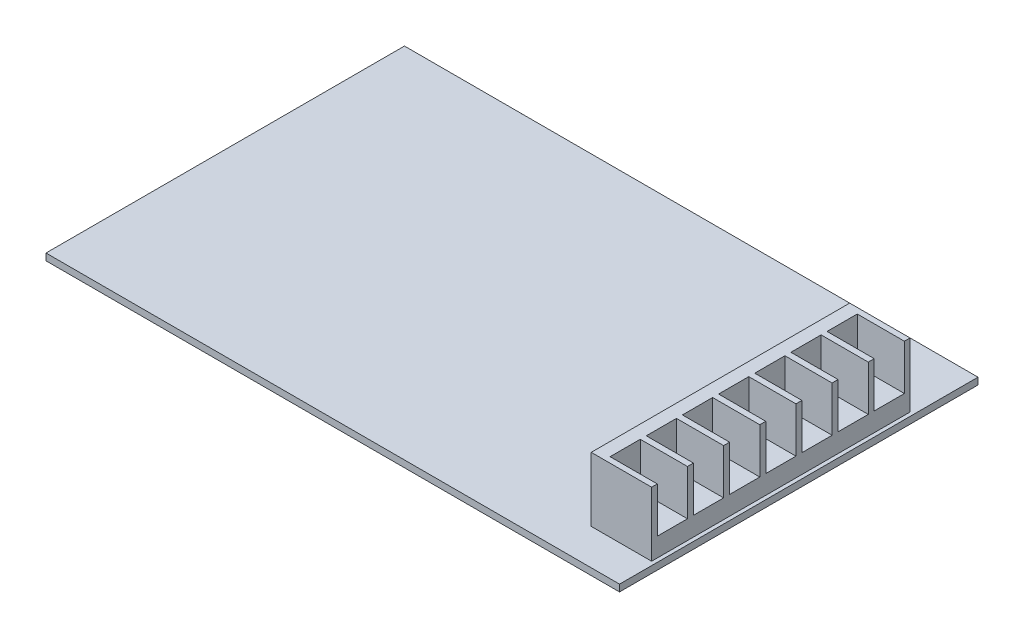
SolidWorks part; units mm, degrees
ref_plane "Спереди" through (0, 0, 0) normal (0, 0, 1) x (1, 0, 0)
ref_plane "Сверху" through (0, 0, 0) normal (0, 1, 0) x (1, 0, 0)
ref_plane "Справа" through (0, 0, 0) normal (1, 0, 0) x (0, 0, -1)
sketch "Эскиз1" plane through (0, 0, 0) normal (0, 1, 0) x (1, 0, 0)
  line L1 (-76, -47.5) -> (76, -47.5)
  line L2 (-76, -47.5) -> (-76, 47.5)
  line L3 (-76, 47.5) -> (76, 47.5)
  line L4 (76, -47.5) -> (76, 47.5)
  line L5 (-76, -47.5) -> (76, 47.5) construction
  line L6 (-76, 47.5) -> (76, -47.5) construction
  point P0 (0, 0)
  dimension "D1" = 152
  dimension "D2" = 95
extrude "Бобышка-Вытянуть1" add sketch "Эскиз1" along normal blind 1.8
sketch "Эскиз2" plane through (0, 1.8, 0) normal (0, 1, 0) x (1, 0, 0)
  line L1 (75, 30.5) -> (59, 30.5)
  line L2 (75, 30.5) -> (75, -38)
  line L3 (75, -38) -> (59, -38)
  line L4 (59, 30.5) -> (59, -38)
  line L5 (-76, -47.5) -> (76, -47.5) construction
  line L6 (76, -47.5) -> (76, 47.5) construction
  dimension "D1" = 9.5
  dimension "D2" = 68.5
  dimension "D3" = 16
  dimension "D4" = 1
extrude "Бобышка-Вытянуть2" add sketch "Эскиз2" along normal blind 17
sketch "Эскиз3" plane through (0, 18.8, 0) normal (0, 1, 0) x (1, 0, 0)
  line L0 (75, -38) -> (75, 30.5) construction
  line L1 (75, -36.5) -> (62.5, -36.5)
  line L2 (75, -36.5) -> (75, -28.5)
  line L3 (75, -28.5) -> (62.5, -28.5)
  line L4 (62.5, -36.5) -> (62.5, -28.5)
  line L5 (59, -38) -> (75, -38) construction
  line L6 (75, -18.9167) -> (62.5, -18.9167)
  line L7 (75, -26.9167) -> (75, -18.9167)
  line L8 (75, -26.9167) -> (62.5, -26.9167)
  line L9 (62.5, -26.9167) -> (62.5, -18.9167)
  line L10 (75, -9.3333) -> (62.5, -9.3333)
  line L11 (75, -17.3333) -> (75, -9.3333)
  line L12 (75, -17.3333) -> (62.5, -17.3333)
  line L13 (62.5, -17.3333) -> (62.5, -9.3333)
  line L14 (75, 0.25) -> (62.5, 0.25)
  line L15 (75, -7.75) -> (75, 0.25)
  line L16 (75, -7.75) -> (62.5, -7.75)
  line L17 (62.5, -7.75) -> (62.5, 0.25)
  line L18 (75, 9.8333) -> (62.5, 9.8333)
  line L19 (75, 1.8333) -> (75, 9.8333)
  line L20 (75, 1.8333) -> (62.5, 1.8333)
  line L21 (62.5, 1.8333) -> (62.5, 9.8333)
  line L22 (75, 19.4167) -> (62.5, 19.4167)
  line L23 (75, 11.4167) -> (75, 19.4167)
  line L24 (75, 11.4167) -> (62.5, 11.4167)
  line L25 (62.5, 11.4167) -> (62.5, 19.4167)
  line L26 (75, 29) -> (62.5, 29)
  line L27 (75, 21) -> (75, 29)
  line L28 (75, 21) -> (62.5, 21)
  line L29 (62.5, 21) -> (62.5, 29)
  line L30 (75, 30.5) -> (59, 30.5) construction
  dimension "D1" = 8
  dimension "D2" = 1.5
  dimension "D3" = 12.5
  dimension "D5" = 1.5
  dimension "D4" = 7
extrude "Вырез-Вытянуть1" cut sketch "Эскиз3" against normal blind 12
